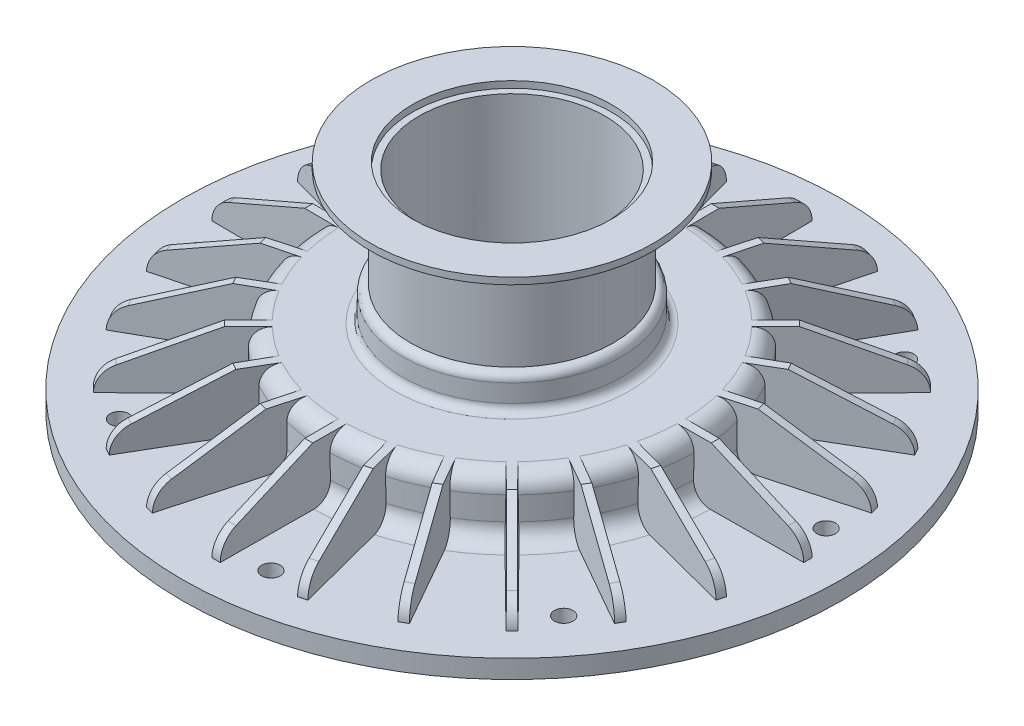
SolidWorks part; units mm, degrees
ref_plane "Ön Düzlem" through (0, 0, 0) normal (0, 0, 1) x (1, 0, 0)
ref_plane "Üst Düzlem" through (0, 0, 0) normal (0, 1, 0) x (1, 0, 0)
ref_plane "Sağ Düzlem" through (0, 0, 0) normal (1, 0, 0) x (0, 0, -1)
sketch "Çizim1" plane through (0, 0, 0) normal (1, 0, 0) x (0, 0, -1)
  line L0 (0, 0) -> (0, 56.1194) construction
  line L1 (-10, 35.35) -> (-70.25, 35.35)
  line L2 (-70.25, 35.35) -> (-70.25, 13.85)
  line L3 (-70.25, 13.85) -> (-124.25, 13.85)
  line L4 (-124.25, 13.85) -> (-124.25, 6.925)
  line L5 (-124.25, 6.925) -> (-111.55, 6.925)
  line L6 (-111.55, 6.925) -> (-111.55, 0)
  line L7 (-111.55, 0) -> (-30.05, 0)
  line L8 (-30.05, 0) -> (-30.05, 6.35)
  line L9 (-30.05, 6.35) -> (-26.88, 6.35)
  line L10 (-26.88, 6.35) -> (-26.88, 25.35)
  line L11 (-26.88, 25.35) -> (-10, 25.35)
  line L12 (-10, 25.35) -> (-10, 35.35)
  dimension "D1" = 10
  dimension "D2" = 60.25
  dimension "D3" = 21.5
  dimension "D4" = 10
  dimension "D5" = 19
  dimension "D6" = 6.35
  dimension "D7" = 81.5
  dimension "D8" = 54
  dimension "D9" = 12.7
  dimension "D10" = 3.17
revolve "Döndür1" add sketch "Çizim1" angle 360 about L0
sketch "Çizim2" plane through (0, 13.85, 0) normal (0, 1, 0) x (1, 0, 0)
  line L0 (0, 0) -> (124.25, 0) construction
  line L1 (0, 0) -> (123.187, 16.2179) construction
  circle A0 centre (104.5974, 13.7705) radius 3.5
  circle A1 centre (0, 0) radius 124.25 construction
  dimension "D1" = 7
  dimension "D2" = 7.5
  dimension "D3" = 105.5
extrude "Kes-Ekstrüzyon1" cut sketch "Çizim2" against normal through all
pattern_circular "Dairesel Kaplama1" count 8 over 360 about axis through (0, 0, 0) along (0, 1, 0) of "Kes-Ekstrüzyon1"
fillet "Radyus1" radius 6.35 2 edges at (0, 13.85, -70.25) (0, 35.35, -70.25)
sketch "Çizim3" plane through (0, 0, 0) normal (0, 0, 1) x (1, 0, 0)
  line L0 (70.25, 20.2) -> (70.25, 29) construction
  line L1 (70.25, 20.2) -> (70.25, 29) construction
  line L2 (63.9, 35.35) -> (76.6, 35.35)
  line L3 (76.6, 35.35) -> (111.55, 20.2)
  line L4 (111.55, 20.2) -> (111.55, 13.85)
  line L5 (124.25, 13.85) -> (-124.25, 13.85) construction
  line L6 (111.55, 13.85) -> (76.6, 13.85) construction
  line L7 (124.25, 6.925) -> (124.25, 13.85) construction
  arc A0 (70.25, 29) -> (63.9, 35.35) centre (63.9, 29) ccw construction
  arc A1 (70.25, 20.2) -> (76.6, 13.85) centre (76.6, 20.2) ccw construction
  arc A2 (70.25, 29) -> (63.9, 35.35) centre (63.9, 29) ccw construction
  arc A3 (70.25, 20.2) -> (76.6, 13.85) centre (76.6, 20.2) ccw construction
  dimension "D1" = 6.35
  dimension "D2" = 12.7
  dimension "D3" = 12.7
rib "Feder1" sketch "Çizim3" sketch "Çizim3" thickness 3 extrusion direction parallel to sketch draft on yes draft angle 1 parameters "D1"=3, "D3"=1
fillet "Radyus2" radius 10 1 edges at (111.55, 20.2, 0)
pattern_circular "Dairesel Kaplama2" count 24 over 360 about axis through (0, 0, 0) along (0, 1, 0) of "Radyus2", "Feder1"
sketch "Çizim4" plane through (0, 35.35, 0) normal (0, 1, 0) x (1, 0, 0)
  circle A0 centre (0, 0) radius 41.25
  dimension "D1" = 82.5
extrude "Yükseklik-Ekstrüzyon1" add sketch "Çizim4" along normal blind 12.7
fillet "Radyus3" radius 3 2 edges at (0, 35.35, -41.25) (0, 48.05, 41.25)
sketch "Çizim5" plane through (0, 48.05, 0) normal (0, 1, 0) x (1, 0, 0)
  circle A0 centre (0, 0) radius 35
  dimension "D1" = 70
extrude "Kes-Ekstrüzyon2" cut sketch "Çizim5" against normal through all
sketch "Çizim6" plane through (0, 0, 0) normal (0, -1, 0) x (1, 0, 0)
  circle A0 centre (0, 0) radius 56.8
  dimension "D1" = 113.6
extrude "Kes-Ekstrüzyon3" cut sketch "Çizim6" against normal blind 25.4
sketch "Çizim7" plane through (0, 48.05, 0) normal (0, 1, 0) x (1, 0, 0)
  circle A0 centre (0, 0) radius 38.25 construction
  circle A1 centre (0, 0) radius 38.25
  circle A2 centre (0, 0) radius 35 construction
  circle A3 centre (0, 0) radius 35
extrude "Yükseklik-Ekstrüzyon2" add sketch "Çizim7" along normal blind 40
sketch "Çizim8" plane through (0, 0, 0) normal (1, 0, 0) x (0, 0, -1)
  line L0 (0, 0) -> (0, 131.3157) construction
  line L2 (38.25, 88.05) -> (53.25, 88.05)
  line L3 (53.25, 88.05) -> (53.25, 85.55)
  line L4 (53.25, 85.55) -> (40.1878, 82.05)
  line L5 (40.1878, 82.05) -> (40.1878, 78.05)
  line L6 (40.1878, 78.05) -> (38.25, 78.05)
  line L7 (38.25, 48.05) -> (38.25, 88.05) construction
  line L8 (38.25, 78.05) -> (38.25, 88.05)
  dimension "D1" = 10
  dimension "D2" = 15
  dimension "D3" = 2.5
  dimension "D4" = 4
  dimension "D5" = 15
revolve "Döndür2" add sketch "Çizim8" angle 360 about L0
sketch "Çizim9" plane through (0, 88.05, 0) normal (0, 1, 0) x (1, 0, 0)
  circle A0 centre (0, 0) radius 35 construction
  circle A1 centre (0, 0) radius 35
  circle A2 centre (0, 0) radius 37.5
  dimension "D1" = 2.5
extrude "Kes-Ekstrüzyon4" cut sketch "Çizim9" against normal blind 2.5
